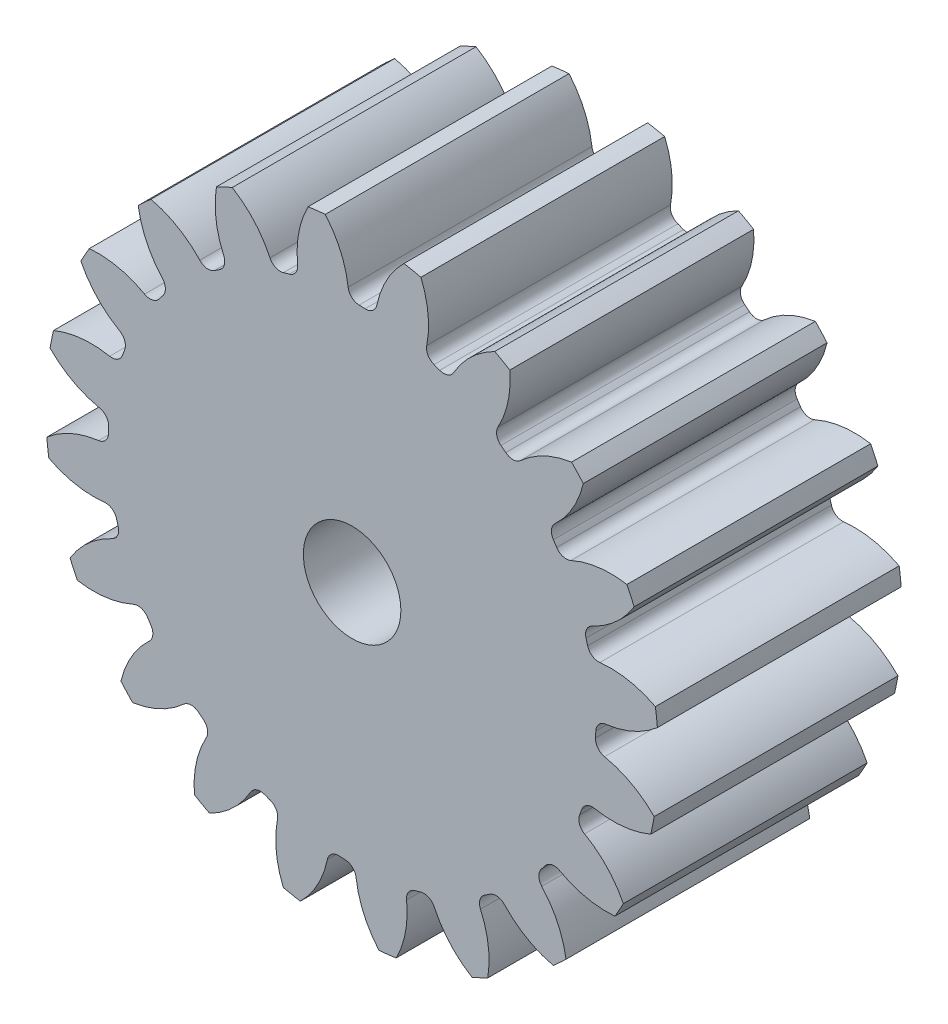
SolidWorks part; units mm, degrees
ref_plane "Front" through (0, 0, 0) normal (0, 0, 1) x (1, 0, 0)
ref_plane "Top" through (0, 0, 0) normal (0, 1, 0) x (1, 0, 0)
ref_plane "Right" through (0, 0, 0) normal (1, 0, 0) x (0, 0, -1)
sketch "Sketch3" plane through (0, 0, 0) normal (0, 0, 1) x (1, 0, 0)
  circle A0 centre (0, 0) radius 111.76
  dimension "od" = 223.52
extrude "gearBody" add sketch "Sketch3" along normal blind 88.9
sketch "Sketch2" plane through (0, 0, 0) normal (0, 0, 1) x (1, 0, 0)
  line L0 (0, 0) -> (88.2053, 36.5358) construction
  line L1 (110.5486, -19.3064) -> (0, 0) construction
  line L2 (0, 0) -> (36.3143, 0) construction
  line L3 (101.5294, 3.7878) -> (100.8762, -12.106) construction
  line L5 (101.2028, -4.1591) -> (0, 0) construction
  line L7 (0, 0) -> (95.4728, 0) construction
  arc A0 (95.4532, 1.9319) -> (94.9728, -9.7578) centre (0, 0) ccw construction
  arc A1 (111.3302, 9.7924) -> (110.1512, -18.8946) centre (0, 0) ccw construction
  arc A2 (101.5294, 3.7878) -> (100.8762, -12.106) centre (0, 0) ccw construction
  arc A3 (88.7727, -4.7563) -> (88.8636, -2.544) centre (0, 0) ccw
  arc A4 (110.5486, -19.3064) -> (92.065, -9.027) centre (84.9099, -43.6503) ccw
  arc A5 (110.5486, -19.3064) -> (111.76, 10.1702) centre (0, 0) ccw
  arc A6 (111.76, 10.1702) -> (92.4953, 1.4422) centre (88.2053, 36.5358) cw
  arc A7 (88.8636, -2.544) -> (92.4953, 1.4422) centre (92.997, -2.6624) cw
  arc A8 (92.065, -9.027) -> (88.7727, -4.7563) centre (92.9019, -4.9775) cw
  point P6 (111.76, 10.1702)
  point P22 (110.5486, -19.3064)
  dimension "baseDia" = 190.9455
  dimension "od" = 223.52
  dimension "pd" = 203.2
  dimension "rd" = 177.8
  dimension "rFillet" = 4.1351
  dimension "pointX" = 111.76
  dimension "pointY" = 10.1702
  dimension "CTT" = 15.8937
  dimension "flankCenterAngle" = 22.5
extrude "toothCut" cut sketch "Sketch2" along normal through all
pattern_circular "CirPattern1" count 20 over 360 about axis through (0, 0, 0) along (0, 0, 1) of "toothCut"
sketch "hub1Dia" plane through (0, 0, 0) normal (0, 0, -1) x (-1, 0, 0)
  circle A0 centre (0, 0) radius 12.7
  dimension "hub1Dia" = 25.4
sketch "hub2Dia" plane through (0, 0, 88.9) normal (0, 0, 1) x (1, 0, 0)
  circle A0 centre (0, 0) radius 12.7
  dimension "hub2dia" = 25.4
sketch "boreDia" plane through (0, 0, 0) normal (0, 0, 1) x (1, 0, 0)
  circle A0 centre (0, 0) radius 17.78
  dimension "boreDia" = 35.56
extrude "bore" cut sketch "boreDia" against normal mid plane 25400
